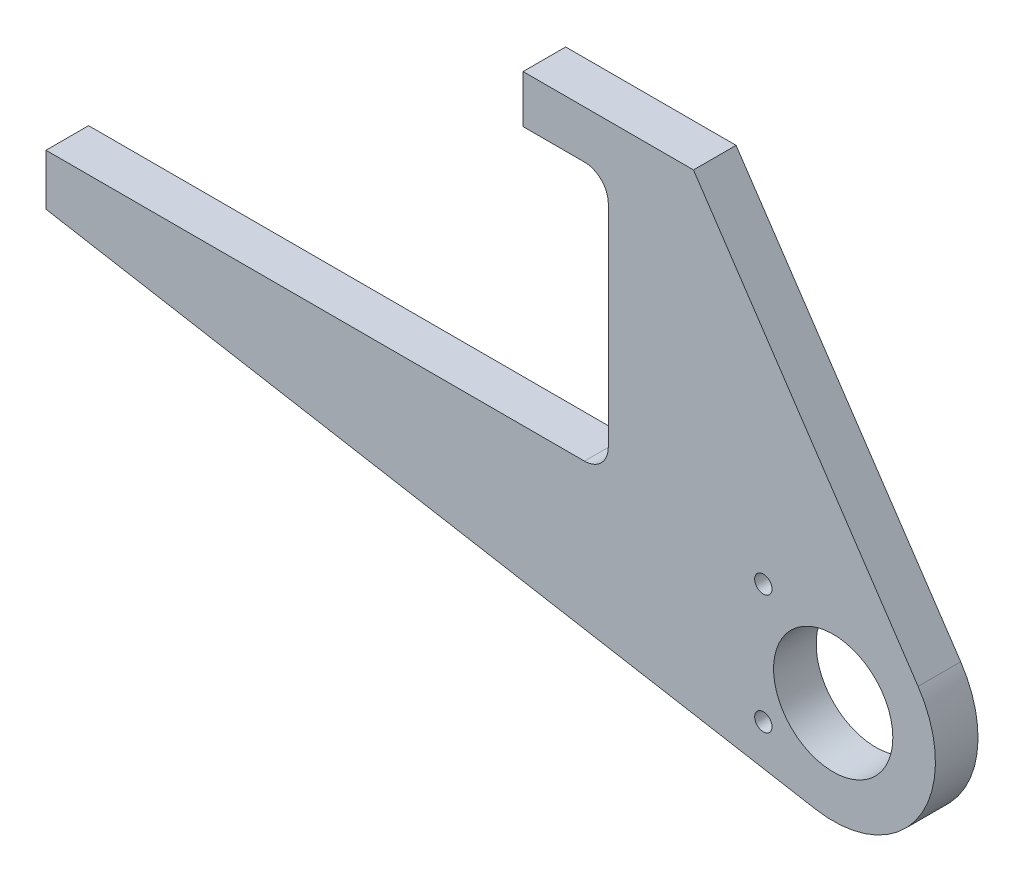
SolidWorks part; units mm, degrees
ref_plane "Plan de face" through (0, 0, 0) normal (0, 0, 1) x (1, 0, 0)
ref_plane "Plan de dessus" through (0, 0, 0) normal (0, 1, 0) x (1, 0, 0)
ref_plane "Plan de droite" through (0, 0, 0) normal (1, 0, 0) x (0, 0, -1)
sketch "Esquisse1" plane through (0, 0, 0) normal (0, 0, 1) x (1, 0, 0)
  line L0 (-462, 50) -> (-146, 50)
  line L1 (-132, 64) -> (-132, 188)
  line L2 (-182, 202) -> (-182, 230)
  line L3 (-82, 230) -> (49.8319, 33.4183)
  line L4 (-10.3507, -59.1005) -> (-462, 20)
  line L5 (-462, 50) -> (-462, 20)
  line L6 (-182, 202) -> (-146, 202)
  line L7 (182.5231, 0) -> (-169.2534, 0) construction
  line L9 (-182, 230) -> (-82, 230)
  arc A0 (49.8319, 33.4183) -> (-10.3507, -59.1005) centre (0, 0) cw
  arc A1 (-146, 202) -> (-132, 188) centre (-146, 188) cw
  circle A2 centre (0, 0) radius 35
  arc A3 (-146, 50) -> (-132, 64) centre (-146, 64) ccw
  point P2 (60, 0)
  point P16 (0, -60)
  point P19 (-132, 202)
  point P22 (-132, 50)
  dimension "D7" = 60
  dimension "D8" = 152
  dimension "D9" = 70
  dimension "D12" = 522
  dimension "D14" = 14
  dimension "D1" = 132
  dimension "D2" = 50
  dimension "D4" = 28
  dimension "D5" = 100
  dimension "D6" = 330
  dimension "D11" = 50
  dimension "D13" = 290
  dimension "D15" = 30
extrude "Extrusion1" add sketch "Esquisse1" along normal blind 25
hole_wizard "Trou taraudé M121" positions "Esquisse3" profile "Esquisse2" tap size "M12" standard "ISO"
sketch "Esquisse3" plane through (0, 0, 25) normal (0, 0, 1) x (1, 0, 0)
  point P0 (-41, 40)
  point P1 (-41, -30)
  dimension "D1" = 41
  dimension "D2" = 40
  dimension "D4" = 70
sketch "Esquisse2" plane through (-41, 40, 25) normal (1, 0, 0) x (0, -1, 0)
  line L0 (0, 0) -> (0, 32.3144)
  line L1 (0, 32.3144) -> (5.1, 29.25)
  line L2 (5.1, 29.25) -> (5.1, 0)
  line L5 (5.1, 0) -> (0, 0)
  line L10 (0, 32.3144) -> (-5.1, 29.25) construction
  line L11 (0, -6.35) -> (0, 107.95) construction
  dimension "Diamètre du trou pour taraudage" = 10.2
  dimension "Profondeur du trou pour taraudage" = 29.25
  dimension "Angle de pointe" = 118
